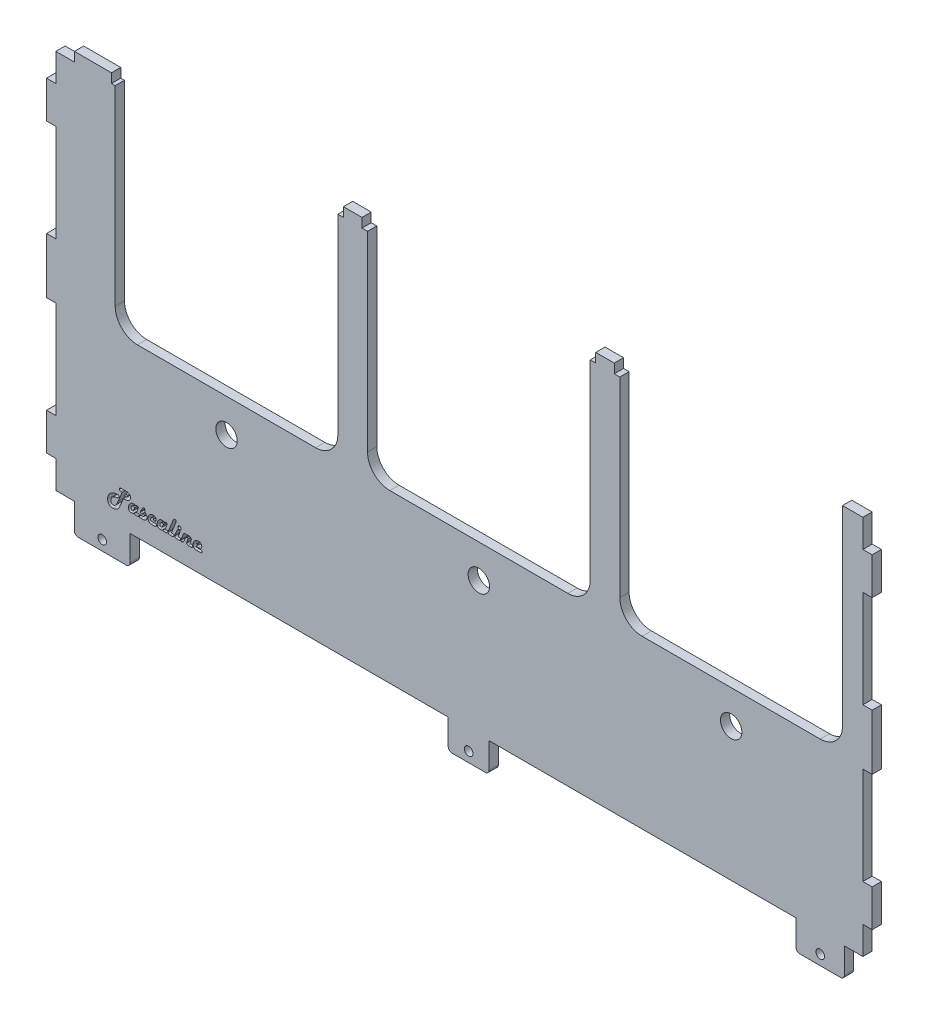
SolidWorks part; units mm, degrees
ref_plane "Front Plane" through (0, 0, 0) normal (0, 0, 1) x (1, 0, 0)
ref_plane "Top Plane" through (0, 0, 0) normal (0, 1, 0) x (1, 0, 0)
ref_plane "Right Plane" through (0, 0, 0) normal (1, 0, 0) x (0, 0, -1)
sketch "Sketch1" plane through (0, 0, 0) normal (0, 0, 1) x (1, 0, 0)
  line L0 (101.6, 130.175) -> (101.6, 0) construction
  line L1 (0, 0) -> (276.225, 0)
  line L2 (0, 0) -> (0, 130.175)
  line L3 (0, 130.175) -> (276.225, 130.175) construction
  line L4 (276.225, 0) -> (276.225, 130.175)
  line L5 (106.68, 130.175) -> (106.68, 57.15)
  line L6 (20.32, 130.175) -> (96.52, 130.175) construction
  line L7 (20.32, 130.175) -> (20.32, 57.15)
  line L8 (20.32, 57.15) -> (96.52, 57.15)
  line L9 (96.52, 130.175) -> (96.52, 57.15)
  line L10 (182.88, 57.15) -> (106.68, 57.15)
  line L11 (182.88, 130.175) -> (182.88, 57.15)
  line L12 (182.88, 130.175) -> (106.68, 130.175) construction
  line L13 (58.42, 45.72) -> (144.78, 45.72) construction
  line L14 (144.78, 45.72) -> (231.14, 45.72) construction
  line L15 (144.78, 130.175) -> (144.78, 0) construction
  line L16 (193.04, 130.175) -> (193.04, 57.15)
  line L17 (269.24, 57.15) -> (193.04, 57.15)
  line L18 (269.24, 130.175) -> (269.24, 57.15)
  line L19 (269.24, 130.175) -> (193.04, 130.175) construction
  line L20 (0, 130.175) -> (20.32, 130.175)
  line L24 (96.52, 130.175) -> (106.68, 130.175)
  line L28 (182.88, 130.175) -> (193.04, 130.175)
  line L32 (269.24, 130.175) -> (276.225, 130.175)
  line L33 (187.96, 130.175) -> (187.96, 0) construction
  circle A0 centre (231.14, 45.72) radius 3.6703
  circle A1 centre (58.42, 45.72) radius 3.6703
  circle A2 centre (144.78, 45.72) radius 3.6703
  point P27 (101.6, 45.72)
  point P28 (58.42, 57.15)
  dimension "D3" = 45.72
  dimension "D5" = 276.225
  dimension "D4" = 7.3406
  dimension "D2" = 86.36
  dimension "D7" = 45.085
  dimension "D8" = 5.08
  dimension "D9" = 57.15
  dimension "D11" = 130.175
extrude "Boss-Extrude1" add sketch "Sketch1" along normal blind 3.175
fillet "Fillet1" radius 7.62 6 edges at (20.32, 57.15, 1.5875) (106.68, 57.15, 1.5875) (182.88, 57.15, 1.5875) (96.52, 57.15, 1.5875) (269.24, 57.15, 1.5875) (193.04, 57.15, 1.5875)
sketch "Sketch2" plane through (0, 0, 0) normal (0, 0, 1) x (1, 0, 0)
  line L0 (193.04, 130.175) -> (182.88, 130.175) construction
  line L1 (0, 65.0875) -> (276.225, 65.0875) construction
  line L2 (0, 130.175) -> (0, 0) construction
  line L3 (276.225, 0) -> (276.225, 130.175) construction
  line L4 (138.1125, 0) -> (138.1125, 130.175) construction
  line L5 (184.785, 130.175) -> (191.135, 130.175)
  line L6 (0, 0) -> (276.225, 0) construction
  line L8 (276.225, 130.175) -> (269.24, 130.175) construction
  line L9 (276.225, 120.65) -> (279.4, 120.65)
  line L10 (276.225, 120.65) -> (276.225, 107.95)
  line L11 (276.225, 107.95) -> (279.4, 107.95)
  line L12 (279.4, 120.65) -> (279.4, 107.95)
  line L13 (279.4, 9.525) -> (279.4, 22.225)
  line L14 (184.785, 130.175) -> (184.785, 133.35)
  line L15 (276.225, 22.225) -> (279.4, 22.225)
  line L16 (276.225, 9.525) -> (276.225, 22.225)
  line L17 (276.225, 9.525) -> (279.4, 9.525)
  line L18 (-3.175, 74.6125) -> (-3.175, 55.5625)
  line L19 (276.225, 74.6125) -> (279.4, 74.6125)
  line L20 (276.225, 74.6125) -> (276.225, 55.5625)
  line L21 (276.225, 55.5625) -> (279.4, 55.5625)
  line L22 (279.4, 74.6125) -> (279.4, 55.5625)
  line L23 (0, 55.5625) -> (-3.175, 55.5625)
  line L24 (0, 74.6125) -> (0, 55.5625)
  line L25 (0, 74.6125) -> (-3.175, 74.6125)
  line L26 (0, 9.525) -> (-3.175, 9.525)
  line L27 (0, 9.525) -> (0, 22.225)
  line L28 (0, 22.225) -> (-3.175, 22.225)
  line L29 (-3.175, 9.525) -> (-3.175, 22.225)
  line L30 (-3.175, 120.65) -> (-3.175, 107.95)
  line L31 (0, 107.95) -> (-3.175, 107.95)
  line L32 (0, 120.65) -> (0, 107.95)
  line L33 (0, 120.65) -> (-3.175, 120.65)
  line L34 (106.68, 130.175) -> (96.52, 130.175) construction
  line L35 (6.35, 0) -> (25.4, 0)
  line L36 (6.35, 0) -> (6.35, -10.033)
  line L37 (6.35, -10.033) -> (25.4, -10.033)
  line L38 (25.4, 0) -> (25.4, -10.033)
  line L39 (134.3025, 0) -> (148.2725, 0)
  line L40 (184.785, 133.35) -> (191.135, 133.35)
  line L41 (191.135, 130.175) -> (191.135, 133.35)
  line L42 (20.32, 130.175) -> (0, 130.175) construction
  line L43 (134.3025, 0) -> (134.3025, -10.033)
  line L44 (134.3025, -10.033) -> (148.2725, -10.033)
  line L45 (148.2725, 0) -> (148.2725, -10.033)
  line L46 (253.365, 0) -> (269.875, 0)
  line L47 (253.365, 0) -> (253.365, -10.033)
  line L48 (253.365, -10.033) -> (269.875, -10.033)
  line L49 (269.875, 0) -> (269.875, -10.033)
  line L50 (98.425, 130.175) -> (104.775, 130.175)
  line L51 (98.425, 130.175) -> (98.425, 133.35)
  line L52 (98.425, 133.35) -> (104.775, 133.35)
  line L53 (104.775, 130.175) -> (104.775, 133.35)
  line L54 (106.68, 130.175) -> (96.52, 130.175) construction
  line L55 (106.68, 130.175) -> (96.52, 130.175) construction
  line L56 (6.35, 130.175) -> (19.05, 130.175)
  line L57 (6.35, 130.175) -> (6.35, 133.35)
  line L58 (6.35, 133.35) -> (19.05, 133.35)
  line L59 (19.05, 130.175) -> (19.05, 133.35)
  point P26 (276.225, 65.0875)
  point P51 (141.2875, -10.033)
  point P58 (101.6, 130.175)
  point P61 (101.6, 130.175)
  point P68 (187.96, 130.175)
  point P69 (187.96, 130.175)
  dimension "D1" = 12.7
  dimension "D2" = 3.175
  dimension "D3" = 9.525
  dimension "D4" = 10.033
  dimension "D5" = 6.35
  dimension "D6" = 6.35
  dimension "D7" = 19.05
  dimension "D8" = 16.51
  dimension "D9" = 3.175
  dimension "D10" = 13.97
  dimension "D11" = 19.05
  dimension "D12" = 6.35
  dimension "D13" = 3.175
  dimension "D14" = 6.35
  dimension "D15" = 12.7
extrude "Boss-Extrude2" add sketch "Sketch2" along normal blind 3.175
hole_wizard "#4 Clearance Hole1" positions "Sketch4" profile "Sketch3" hole size "#4" standard "ANSI Inch"
sketch "Sketch4" plane through (0, 0, 3.175) normal (0, 0, 1) x (1, 0, 0)
  line L12 (148.2725, 0) -> (253.365, 0) construction
  line L16 (6.35, -10.033) -> (25.4, -10.033) construction
  line L17 (134.3025, -10.033) -> (148.2725, -10.033) construction
  line L18 (253.365, -10.033) -> (269.875, -10.033) construction
  point P0 (141.2875, -6.604)
  point P2 (261.62, -6.604)
  point P4 (15.875, -6.604)
  point P62 (15.875, -10.033)
  point P65 (141.2875, -10.033)
  point P68 (261.62, -10.033)
  dimension "D1" = 6.604
sketch "Sketch3" plane through (141.2875, -6.604, 3.175) normal (1, 0, 0) x (0, -1, 0)
  line L0 (0, 0) -> (0, 3.1751)
  line L1 (0, 3.1751) -> (1.4732, 3.1751)
  line L2 (1.4732, 3.1751) -> (1.4732, 0)
  line L5 (1.4732, 0) -> (0, 0)
  line L11 (0, -6.35) -> (0, 107.95) construction
  dimension "Thru Hole Dia." = 2.9464
  dimension "Thru Hole Depth" = 3.1751
fillet "Fillet2" radius 1.27 6 edges at (269.875, -10.033, 1.5875) (253.365, -10.033, 1.5875) (148.2725, -10.033, 1.5875) (134.3025, -10.033, 1.5875) (25.4, -10.033, 1.5875) (6.35, -10.033, 1.5875)
sketch "Sketch5" plane through (0, 0, 3.175) normal (0, 0, 1) x (1, 0, 0)
  text T0 "Pascaline" font "Harlow Solid Italic" height in points 18
  dimension "D1" = 17.78
  dimension "D2" = 6.35
extrude "Cut-Extrude1" cut sketch "Sketch5" against normal through all
